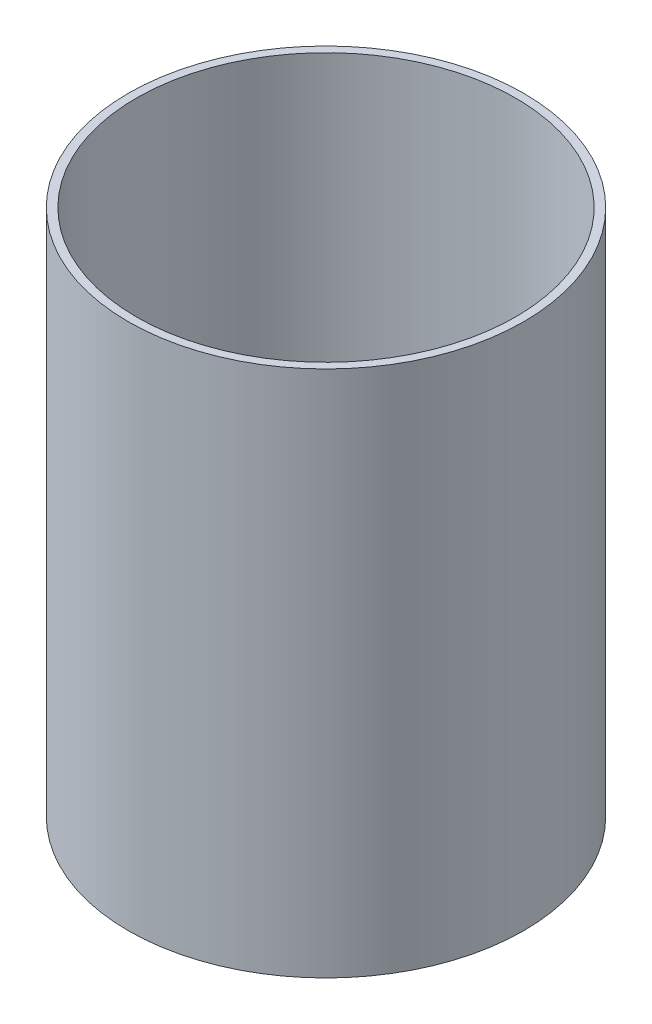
SolidWorks part; units mm, degrees
ref_plane "Front Plane" through (0, 0, 0) normal (0, 0, 1) x (1, 0, 0)
ref_plane "Top Plane" through (0, 0, 0) normal (0, 1, 0) x (1, 0, 0)
ref_plane "Right Plane" through (0, 0, 0) normal (1, 0, 0) x (0, 0, -1)
sketch "Sketch1" plane through (0, 0, 0) normal (0, 1, 0) x (1, 0, 0)
  circle A0 centre (0, 0) radius 19.05
  circle A1 centre (0, 0) radius 18.2626
extrude "Boss-Extrude1" add sketch "Sketch1" along normal blind 50.8
